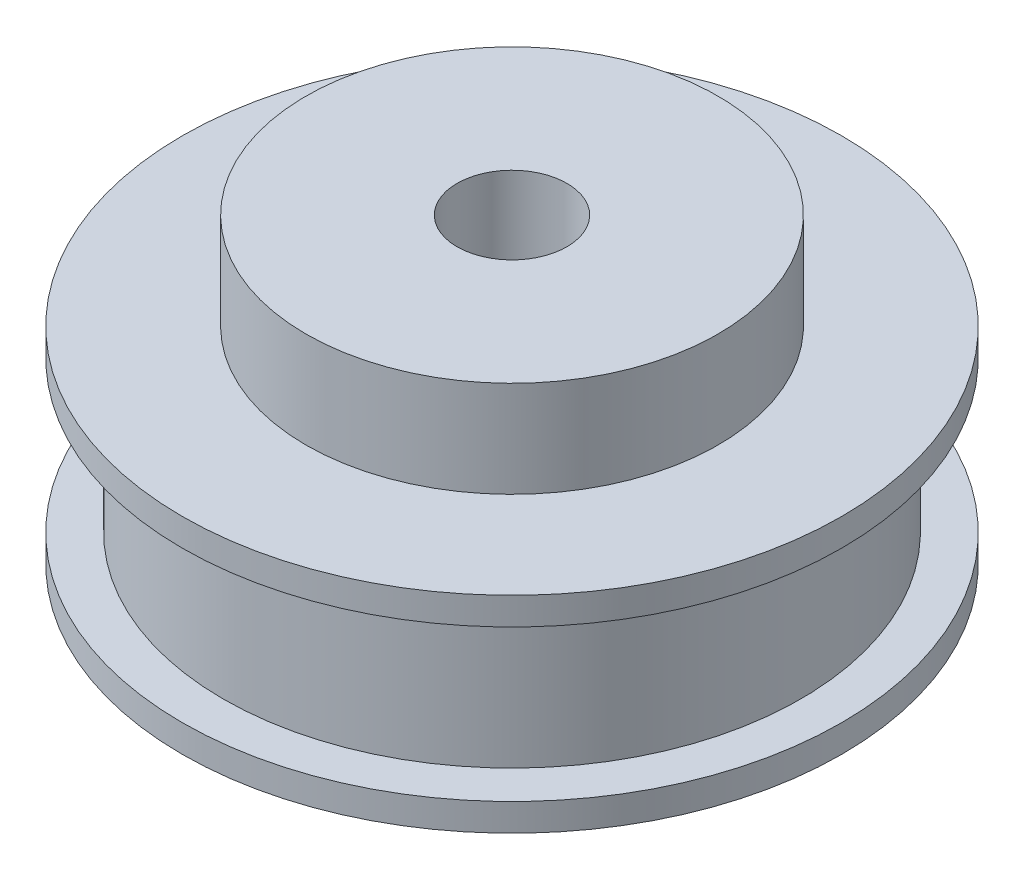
SolidWorks part; units mm, degrees
ref_plane "Alzado" through (0, 0, 0) normal (0, 0, 1) x (1, 0, 0)
ref_plane "Planta" through (0, 0, 0) normal (0, 1, 0) x (1, 0, 0)
ref_plane "Vista lateral" through (0, 0, 0) normal (1, 0, 0) x (0, 0, -1)
sketch "Croquis1" plane through (0, 0, 0) normal (0, 1, 0) x (1, 0, 0)
  circle A0 centre (0, 0) radius 24
extrude "Extruir1" add sketch "Croquis1" along normal blind 2
sketch "Croquis2" plane through (0, 2, 0) normal (0, 1, 0) x (1, 0, 0)
  circle A0 centre (0, 0) radius 21.02
extrude "Extruir2" add sketch "Croquis2" along normal blind 11
sketch "Croquis3" plane through (0, 13, 0) normal (0, 1, 0) x (1, 0, 0)
  circle A0 centre (0, 0) radius 24
extrude "Extruir3" add sketch "Croquis3" along normal blind 2
sketch "Croquis11" plane through (0, 15, 0) normal (0, 1, 0) x (1, 0, 0)
  circle A0 centre (0, 0) radius 15
extrude "Extruir7" add sketch "Croquis11" along normal blind 7
sketch "Croquis12" plane through (0, 22, 0) normal (0, 1, 0) x (1, 0, 0)
  point P0 (0, 0)
hole_wizard "Taladro de diámetro de Ø8.0 (8)1" positions "Croquis3D1" profile "Croquis13" hole size "Ø8.0" standard "ISO"
sketch3d "Croquis3D1"
  point P0 (0, 22, 0)
sketch "Croquis13" plane through (0, 22, 0) normal (1, 0, 0) x (0, 0, 1)
  line L0 (0, 0) -> (0, 22)
  line L1 (0, 22) -> (4, 22)
  line L2 (4, 22) -> (4, 0)
  line L5 (4, 0) -> (0, 0)
  line L11 (0, -6.35) -> (0, 107.95) construction
  dimension "Diámetro de taladro hasta el siguiente" = 8
  dimension "Profundidad de taladro hasta el siguiente" = 22
